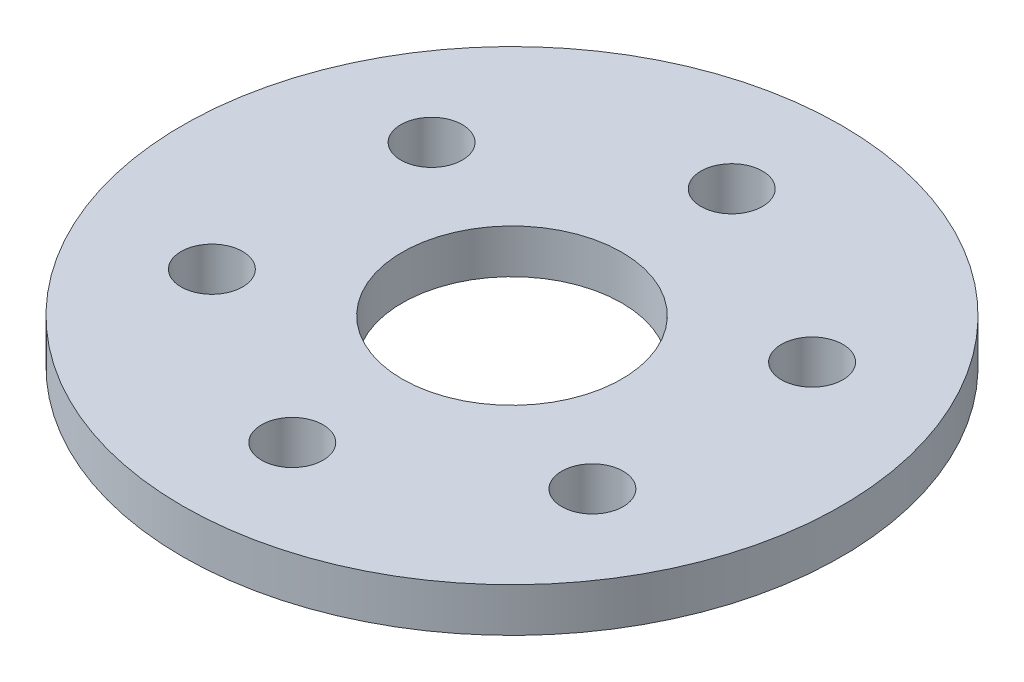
SolidWorks part; units mm, degrees
ref_plane "Front Plane" through (0, 0, 0) normal (0, 0, 1) x (1, 0, 0)
ref_plane "Top Plane" through (0, 0, 0) normal (0, 1, 0) x (1, 0, 0)
ref_plane "Right Plane" through (0, 0, 0) normal (1, 0, 0) x (0, 0, -1)
sketch "Sketch1" plane through (0, 0, 0) normal (0, 1, 0) x (1, 0, 0)
  circle A0 centre (0, 0) radius 37.5
  circle A1 centre (0, 0) radius 12.5
  dimension "D1" = 75
  dimension "D2" = 25
extrude "Extrude1" add sketch "Sketch1" along normal blind 5
hole_wizard "M8x1.0 Tapped Hole1" positions "Sketch5" profile "Sketch4" tap size "M8x1.0" standard "Ansi Metric"
sketch "Sketch5" plane through (-43.8674, 5, -24.3176) normal (0, 1, 0) x (-1, 0, 0)
  line L0 (-43.8674, 36.8176) -> (-43.8674, 61.8176) construction
  circle A0 centre (-43.8674, 24.3176) radius 37.5 construction
  circle A1 centre (-43.8674, 24.3176) radius 12.5 construction
  point P0 (-43.8674, 49.3176)
sketch "Sketch4" plane through (0, 5, 25) normal (1, 0, 0) x (0, 0, 1)
  line L0 (0, 0) -> (0, 5)
  line L1 (0, 5) -> (3.5, 5)
  line L2 (3.5, 5) -> (3.5, 0)
  line L5 (3.5, 0) -> (0, 0)
  line L11 (0, -6.35) -> (0, 107.95) construction
  dimension "Thru Tap Drill Dia." = 7
  dimension "Thru Tap Drill Depth" = 5
pattern_circular "CirPattern1" count 6 over 360 about axis through (0, 0, 0) along (0, 1, 0) of "M8x1.0 Tapped Hole1"
